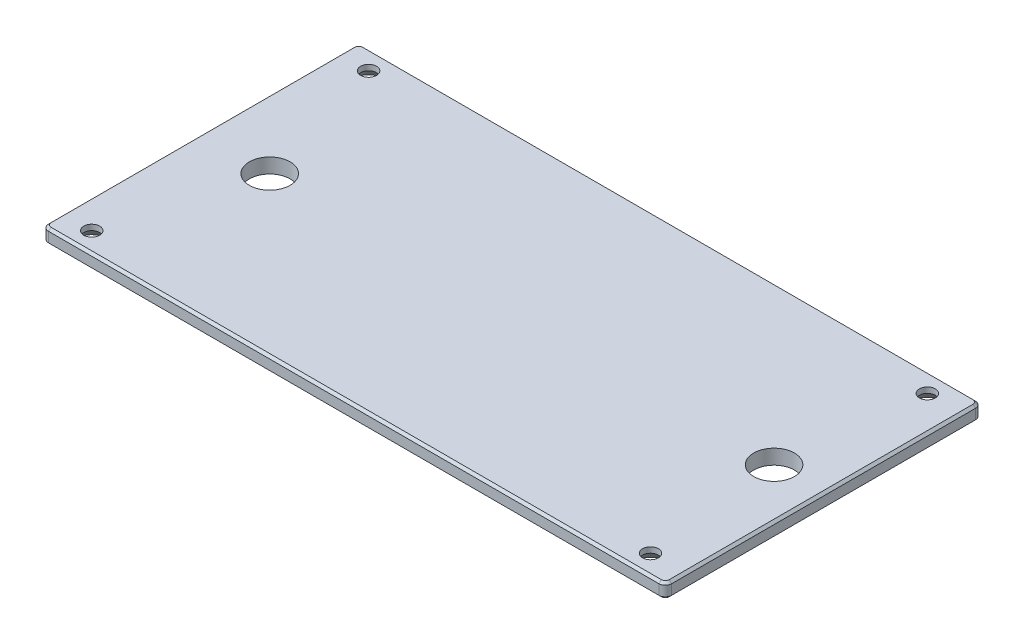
SolidWorks part; units mm, degrees
ref_plane "Front Plane" through (0, 0, 0) normal (0, 0, 1) x (1, 0, 0)
ref_plane "Top Plane" through (0, 0, 0) normal (0, 1, 0) x (1, 0, 0)
ref_plane "Right Plane" through (0, 0, 0) normal (1, 0, 0) x (0, 0, -1)
sketch "Sketch1" plane through (0, 0, 0) normal (0, 1, 0) x (1, 0, 0)
  line L1 (-98.425, 50.8) -> (101.6, 50.8)
  line L2 (-98.425, 50.8) -> (-98.425, -50.8)
  line L3 (-98.425, -50.8) -> (101.6, -50.8)
  line L4 (101.6, 50.8) -> (101.6, -50.8)
  dimension "D1" = 101.6
  dimension "D2" = 200.025
  dimension "D3" = 98.425
  dimension "D4" = 50.8
extrude "Boss-Extrude1" add sketch "Sketch1" along normal blind 4.7498
hole_wizard "CSK for #10 Flat Head Socket Cap Screw1" positions "Sketch13" profile "Sketch12" countersink size "#10" standard "ANSI Inch"
sketch "Sketch13" plane through (0, 0, 0) normal (0, -1, 0) x (-1, 0, 0)
  line L0 (-119.9309, 0) -> (113.2375, 0) construction
  line L2 (0, -63.6486) -> (0, 67.662) construction
  point P0 (88.9, -44.45)
  point P2 (-90.5002, -44.45)
  point P4 (-90.5002, 44.45)
  point P6 (88.9, 44.45)
  dimension "D1" = 44.45
  dimension "D2" = 88.9
  dimension "D3" = 90.5002
sketch "Sketch12" plane through (-88.9, 0, 44.45) normal (1, 0, 0) x (0, 0, -1)
  line L0 (0, 0) -> (0, 12.9441)
  line L1 (0, 12.9441) -> (2.5527, 10.0076)
  line L2 (2.5527, 10.0076) -> (2.5527, 2.9634)
  line L3 (2.5527, 2.9634) -> (5.1288, 0)
  line L5 (5.1288, 0) -> (0, 0)
  line L6 (-2.5527, 2.9634) -> (-5.1288, 0) construction
  line L10 (0, 12.9441) -> (-2.5527, 10.0076) construction
  line L11 (0, -6.35) -> (0, 107.95) construction
  dimension "Hole Dia." = 5.1054
  dimension "Hole Depth" = 10.0076
  dimension "Near C'Sink Dia." = 10.2575
  dimension "Near C'Sink Angle" = 82
  dimension "Drill Angle" = 82
hole_wizard "Hole1" positions "Sketch15" profile "Sketch14" legacy
sketch "Sketch15" plane through (0, 0, 0) normal (0, -1, 0) x (-1, 0, 0)
  point P0 (76.2, 0)
  point P2 (-85.725, 0)
  dimension "D1" = 76.2
  dimension "D2" = 85.725
sketch "Sketch14" plane through (-76.2, 0, 0) normal (1, 0, 0) x (0, 0, -1)
  line L0 (0, 0) -> (0, 4.7498)
  line L1 (0, 4.7498) -> (6.5405, 4.7498)
  line L2 (6.5405, 4.7498) -> (6.5405, 0)
  line L3 (6.5405, 0) -> (0, 0)
  line L4 (0, 110) -> (0, -10) construction
  dimension "Diameter" = 13.081
  dimension "Depth" = 4.7498
fillet "Fillet1" radius 2.032 4 edges at (-98.425, 2.3749, -50.8) (101.6, 2.3749, -50.8) (101.6, 2.3749, 50.8) (-98.425, 2.3749, 50.8)
chamfer "Chamfer1" distance 0.762 angle 45 16 edges at (101.6, 4.7498, 0) (1.5875, 4.7498, -50.8) (-98.425, 4.7498, 0) (-97.8298, 4.7498, -50.2048) (101.0048, 4.7498, -50.2048) (-97.8298, 4.7498, 50.2048) (101.0048, 4.7498, 50.2048) (1.5875, 4.7498, 50.8) (101.0048, 0, 50.2048) (101.0048, 0, -50.2048) (101.6, 0, 0) (1.5875, 0, 50.8) (-97.8298, 0, -50.2048) (-97.8298, 0, 50.2048) (-98.425, 0, 0) (1.5875, 0, -50.8)
